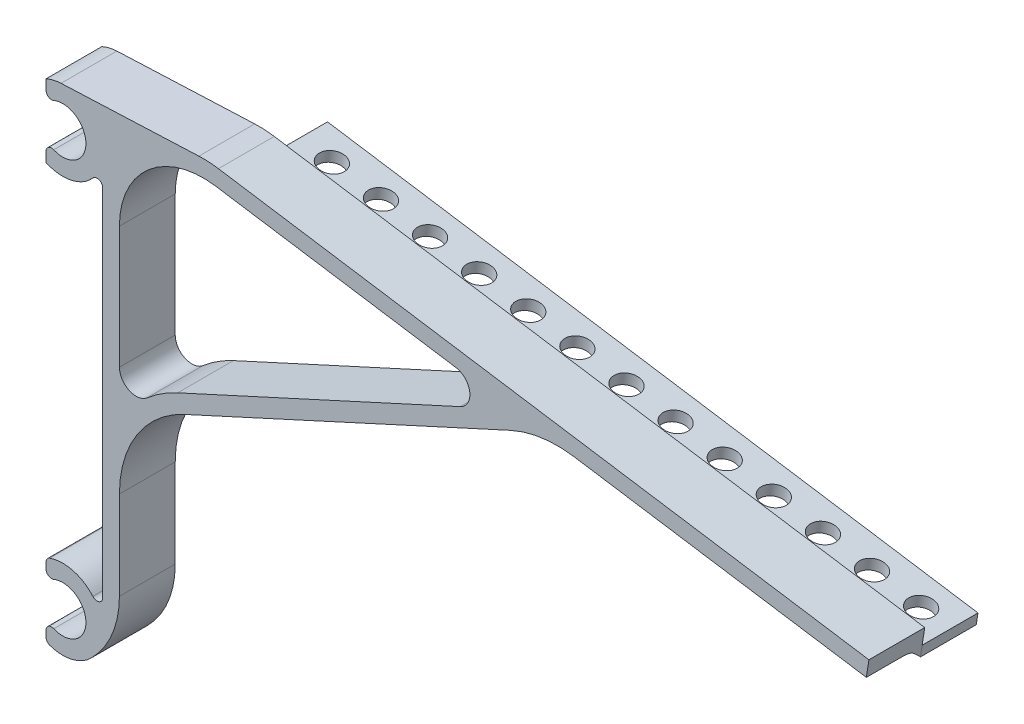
SolidWorks part; units mm, degrees
ref_plane "Front Plane" through (0, 0, 0) normal (0, 0, 1) x (1, 0, 0)
ref_plane "Top Plane" through (0, 0, 0) normal (0, 1, 0) x (1, 0, 0)
ref_plane "Right Plane" through (0, 0, 0) normal (1, 0, 0) x (0, 0, -1)
sketch "Sketch1" plane through (0, 0, 0) normal (0, 0, 1) x (1, 0, 0)
  line L0 (5.2111, 18.6402) -> (5.2111, 15.0175)
  line L1 (5.2111, 83.5807) -> (5.2111, 79.958)
  line L2 (5.2111, 92.9384) -> (5.2111, 89.3157)
  line L4 (5.2111, 9.2825) -> (5.2111, 5.6598)
  line L5 (152.1685, 73.5542) -> (35.642, 91.4813)
  line L6 (36.0981, 94.4464) -> (152.6248, 76.5193)
  line L7 (7.9079, 93.5918) -> (32.5979, 94.6396)
  line L9 (8.2111, 12.15) -> (17.5488, 14.037) construction
  line L11 (18.3611, 76.6558) -> (18.3611, 19.2292)
  line L12 (15.3611, 81.1003) -> (15.3611, 17.4979)
  line L14 (13.3365, 7.1631) -> (13.2478, 7.0751)
  line L17 (152.6248, 76.5193) -> (152.1685, 73.5542)
  arc A0 (5.2111, 83.5807) -> (5.2111, 89.3157) centre (8.2111, 86.4482) ccw
  arc A1 (5.2111, 9.2825) -> (5.2111, 15.0175) centre (8.2111, 12.15) ccw
  arc A3 (5.2111, 5.6598) -> (13.2478, 7.0751) centre (8.2111, 12.15) ccw
  arc A4 (7.9079, 93.5918) -> (5.2111, 92.9384) centre (8.2111, 86.4482) ccw
  arc A5 (36.0981, 94.4464) -> (32.5979, 94.6396) centre (33.3611, 76.6558) ccw
  circle A6 centre (8.2111, 12.15) radius 7.15 construction
  circle A7 centre (8.2111, 12.15) radius 4.15 construction
  arc A8 (13.6065, 16.8417) -> (5.2111, 18.6402) centre (8.2111, 12.15) ccw
  arc A9 (15.3611, 17.4979) -> (13.6065, 16.8417) centre (14.3611, 17.4979) cw
  arc A10 (18.3611, 19.2292) -> (13.3365, 7.1631) centre (1.3611, 19.2292) cw
  arc A11 (35.642, 91.4813) -> (18.3611, 76.6558) centre (33.3611, 76.6558) ccw
  arc A12 (36.0981, 94.4464) -> (15.3611, 76.6558) centre (33.3611, 76.6558) ccw construction
  arc A13 (5.2111, 79.958) -> (13.6065, 81.7565) centre (8.2111, 86.4482) ccw
  arc A14 (15.3611, 81.1003) -> (13.6065, 81.7565) centre (14.3611, 81.1003) ccw
  dimension "D1" = 8.3
  dimension "D4" = 3
  dimension "D5" = 74.2982
  dimension "D8" = 1
  dimension "D9" = 17
  dimension "D7" = 15
  dimension "D11" = 1
  dimension "D3" = 3
  dimension "D2" = 3
  dimension "D10" = 3
sketch "Sketch2" plane through (0, 0, 0) normal (0, 0, 1) x (1, 0, 0)
  line L0 (30.0378, 53.2867) -> (88.4598, 80.0255)
  line L1 (18.3611, 76.6558) -> (18.3611, 19.2292) construction
  line L2 (152.1685, 73.5542) -> (35.642, 91.4813) construction
  line L3 (28.7893, 56.0146) -> (87.2113, 82.7533)
  line L4 (15.3611, 35.1009) -> (18.3611, 35.1009)
  line L5 (99.8242, 81.6071) -> (100.2804, 84.5722)
  arc A0 (88.4598, 80.0255) -> (99.8242, 81.6071) centre (96.7831, 61.8397) cw
  arc A1 (30.0378, 53.2867) -> (18.3611, 35.1009) centre (38.3611, 35.1009) ccw
  arc A2 (28.7893, 56.0146) -> (15.3611, 35.1009) centre (38.3611, 35.1009) ccw
  arc A3 (87.2113, 82.7533) -> (100.2804, 84.5722) centre (96.7831, 61.8397) cw
  point P8 (93.9052, 82.5177)
  point P11 (18.3611, 47.9425)
  dimension "D1" = 20
  dimension "D2" = 3
extrude "Boss-Extrude1" add sketch "Sketch1" along normal blind 10
extrude "Boss-Extrude2" add sketch "Sketch2" along normal blind 10
fillet "Fillet1" radius 3 2 edges at (88.5985, 83.3342, 5) (18.3611, 46.4588, 5)
fillet "Fillet2" radius 1 6 edges at (5.2111, 5.6598, 5) (5.2111, 9.2825, 5) (5.2111, 18.6402, 5) (5.2111, 15.0175, 5) (5.2111, 89.3157, 5) (5.2111, 83.5807, 5)
sketch "Sketch3" plane through (0, 0, 0) normal (0, 0, 1) x (1, 0, 0)
  line L0 (152.3967, 75.0367) -> (155.3375, 74.5841) construction
  line L2 (151.8645, 71.5774) -> (35.3378, 89.5046)
  line L3 (35.87, 92.9639) -> (35.3378, 89.5046)
  line L4 (151.8645, 71.5774) -> (152.3967, 75.0367)
  line L5 (152.3967, 75.0367) -> (35.87, 92.9639)
  line L6 (152.1685, 73.5542) -> (152.6248, 76.5193) construction
extrude "Boss-Extrude3" add sketch "Sketch3" against normal blind 10
chamfer "Chamfer1" distance 2 angle 45 5 edges at (80.2359, 84.0637, 0) (57.1248, 88.1763, 0) (95.3271, 81.7866, 0) (125.9964, 77.5806, 0) (35.6419, 91.4813, 0)
fillet "Fillet3" radius 3 5 edges at (95.3271, 81.7866, 2) (80.2359, 84.0637, 2) (125.9964, 77.5806, 2) (57.1248, 88.1763, 2) (35.6419, 91.4813, 2)
ref_plane "Plane1" through (15.0289, 97.6879, 0) normal (0.1521, 0.9884, 0) x (-0.9884, 0.1521, 0)
sketch "Sketch4" plane through (15.0289, 97.6879, 0) normal (0.1521, 0.9884, 0) x (-0.9884, 0.1521, 0)
  line L0 (-139.2147, -5) -> (-21.317, -5) construction
  line L1 (-139.2147, -10) -> (-139.2147, 0) construction
  line L2 (-21.317, -10) -> (-21.317, 0) construction
  circle A0 centre (-133.9647, -5) radius 2.25
  circle A2 centre (-125.0647, -5) radius 2.25
  circle A3 centre (-116.1647, -5) radius 2.25
  circle A4 centre (-107.2647, -5) radius 2.25
  circle A5 centre (-98.3647, -5) radius 2.25
  circle A6 centre (-89.4647, -5) radius 2.25
  circle A7 centre (-80.5647, -5) radius 2.25
  circle A8 centre (-71.6647, -5) radius 2.25
  circle A9 centre (-62.7647, -5) radius 2.25
  circle A10 centre (-53.8647, -5) radius 2.25
  circle A11 centre (-44.9647, -5) radius 2.25
  circle A12 centre (-36.0647, -5) radius 2.25
  circle A13 centre (-27.1647, -5) radius 2.25
  dimension "D1" = 4.5
  dimension "D2" = 5.25
sketch "Sketch5" plane through (15.0289, 97.6879, 0) normal (0.1521, 0.9884, 0) x (-0.9884, 0.1521, 0)
  line L1 (-21.317, 0) -> (-139.2147, 0)
  line L2 (-21.317, 0) -> (-21.317, -10)
  line L3 (-21.317, -10) -> (-139.2147, -10)
  line L4 (-139.2147, 0) -> (-139.2147, -10)
extrude "Cut-Extrude1" cut sketch "Sketch5" against normal blind 3
extrude "Cut-Extrude2" cut sketch "Sketch4" against normal blind 6
